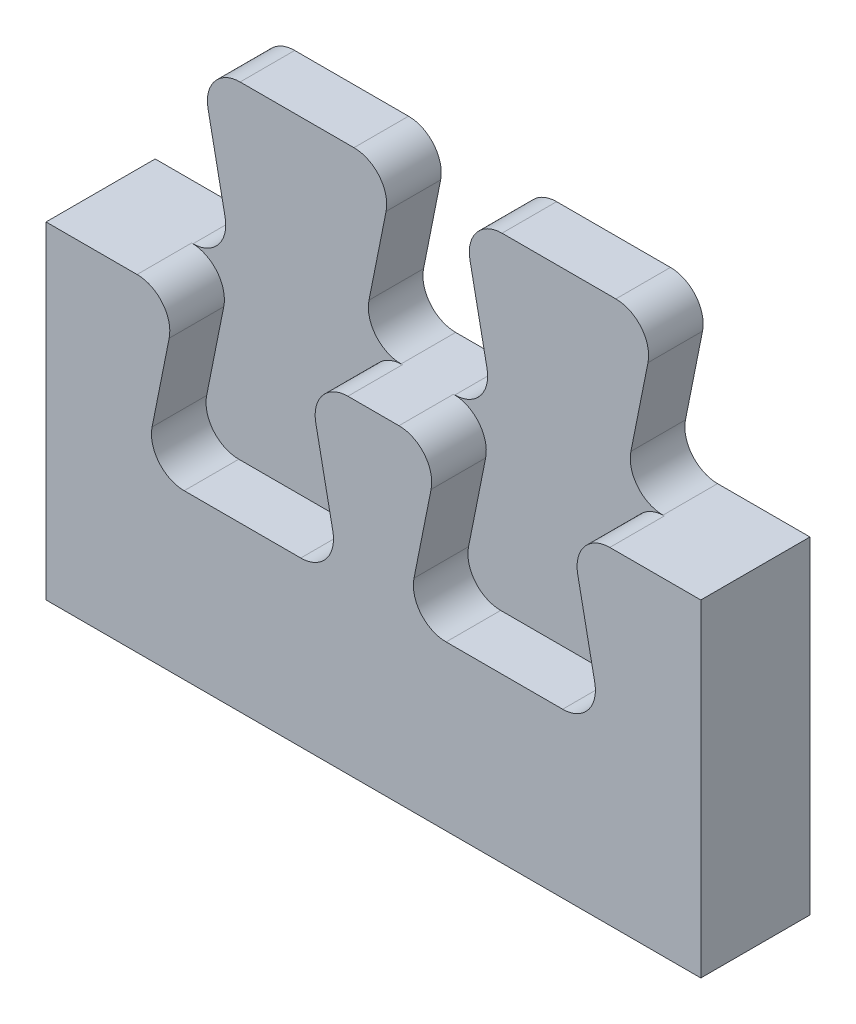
SolidWorks part; units mm, degrees
ref_plane "Ebene vorne" through (0, 0, 0) normal (0, 0, 1) x (1, 0, 0)
ref_plane "Ebene oben" through (0, 0, 0) normal (0, 1, 0) x (1, 0, 0)
ref_plane "Ebene rechts" through (0, 0, 0) normal (1, 0, 0) x (0, 0, -1)
sketch "Skizze1" plane through (0, 0, 0) normal (0, 0, 1) x (1, 0, 0)
  line L0 (-23.8589, 36.6112) -> (-11.7339, 36.6112)
  line L3 (-11.7339, 36.6112) -> (-14.7339, 51.6112)
  line L4 (-14.7339, 51.6112) -> (3.0161, 51.6112)
  line L5 (3.0161, 51.6112) -> (0.0161, 36.6112)
  line L6 (0.0161, 36.6112) -> (12.2661, 36.6112)
  line L7 (12.2661, 36.6112) -> (9.2661, 51.6112)
  line L8 (9.2661, 51.6112) -> (27.0161, 51.6112)
  line L9 (27.0161, 51.6112) -> (24.0161, 36.6112)
  line L10 (24.0161, 36.6112) -> (36.1411, 36.6112)
  line L11 (-23.8589, 36.6112) -> (-23.8589, 6.6112)
  line L12 (-23.8589, 6.6112) -> (36.1411, 6.6112)
  line L13 (36.1411, 6.6112) -> (36.1411, 36.6112)
  point P1 (-23.8589, 36.6112)
  point P3 (-14.7339, 51.6112)
  point P6 (-11.7339, 36.6112)
  point P7 (0.0161, 36.6112)
  point P8 (3.0161, 51.6112)
  point P9 (12.2661, 36.6112)
  point P10 (9.2661, 51.6112)
  point P11 (27.0161, 51.6112)
  point P12 (24.0161, 36.6112)
  point P15 (36.1411, 36.6112)
  dimension "D1" = 60
  dimension "D2" = 12.125
  dimension "D3" = 12.25
  dimension "D4" = 17.75
  dimension "D5" = 15
  dimension "D6" = 15
  dimension "D7" = 15
  dimension "D8" = 0
  dimension "D9" = 17.75
  dimension "D10" = 3
  dimension "D11" = 3
  dimension "D12" = 12.125
  dimension "D13" = 3
  dimension "D14" = 3
  dimension "D18" = 30
extrude "Aufsatz-Linear austragen2" add sketch "Skizze1" along normal blind 10 contours L4 L5 L6 L7 L8 L9 L10 L13 L12 L11 L0 L3
sketch "Skizze4" plane through (0, 0, 10) normal (0, 0, 1) x (1, 0, 0)
  line L0 (-23.8589, 36.6112) -> (-23.8589, 6.6112) construction
  line L1 (-23.8589, 36.6112) -> (-11.8589, 36.6112)
  line L2 (-11.8589, 36.6112) -> (-14.8589, 21.6112)
  line L3 (-14.8589, 21.6112) -> (3.1411, 21.6112)
  line L4 (3.1411, 21.6112) -> (0.1411, 36.6112)
  line L5 (0.1411, 36.6112) -> (12.1411, 36.6112)
  line L6 (12.1411, 36.6112) -> (9.1411, 21.6112)
  line L7 (9.1411, 21.6112) -> (27.1411, 21.6112)
  line L8 (27.1411, 21.6112) -> (24.1411, 36.6112)
  line L9 (24.1411, 36.6112) -> (36.1411, 36.6112)
  line L10 (36.1411, 6.6112) -> (36.1411, 36.6112) construction
  line L11 (-23.8589, 36.6112) -> (-11.7339, 36.6112) construction
  line L12 (24.0161, 36.6112) -> (36.1411, 36.6112) construction
  line L13 (-23.8589, 36.6112) -> (-23.8589, 56.6112)
  line L14 (-23.8589, 56.6112) -> (36.1411, 56.6112)
  line L15 (36.1411, 56.6112) -> (36.1411, 36.6112)
  point P0 (-23.8589, 36.6112)
  point P1 (-11.8589, 36.6112)
  point P4 (-14.8589, 21.6112)
  point P5 (3.1411, 21.6112)
  point P6 (0.1411, 36.6112)
  point P7 (12.1411, 36.6112)
  point P8 (24.1411, 36.6112)
  point P9 (9.1411, 21.6112)
  point P10 (27.1411, 21.6112)
  dimension "D1" = 12
  dimension "D2" = 18
  dimension "D3" = 18
  dimension "D4" = 12
  dimension "D5" = 3
  dimension "D6" = 3
  dimension "D7" = 12
  dimension "D8" = 0
  dimension "D9" = 0
  dimension "D10" = 15
  dimension "D11" = 15
  dimension "D12" = 15
  dimension "D13" = 3
  dimension "D14" = 60
  dimension "D15" = 20
extrude "Schnitt-Linear austragen1" cut sketch "Skizze4" against normal blind 5
fillet "Verrundung6" radius 3 12 edges at (27.1411, 21.6112, 7.5) (9.1411, 21.6112, 7.5) (12.1411, 36.6112, 7.5) (24.1411, 36.6112, 7.5) (27.0161, 51.6112, 2.5) (9.2661, 51.6112, 2.5) (3.0161, 51.6112, 2.5) (-14.7339, 51.6112, 2.5) (-14.8589, 21.6112, 7.5) (3.1411, 21.6112, 7.5) (0.1411, 36.6112, 7.5) (-11.8589, 36.6112, 7.5)
fillet "Verrundung7" radius 3 4 edges at (24.0161, 36.6112, 2.5) (12.2661, 36.6112, 2.5) (0.0161, 36.6112, 2.5) (-11.7339, 36.6112, 2.5)
